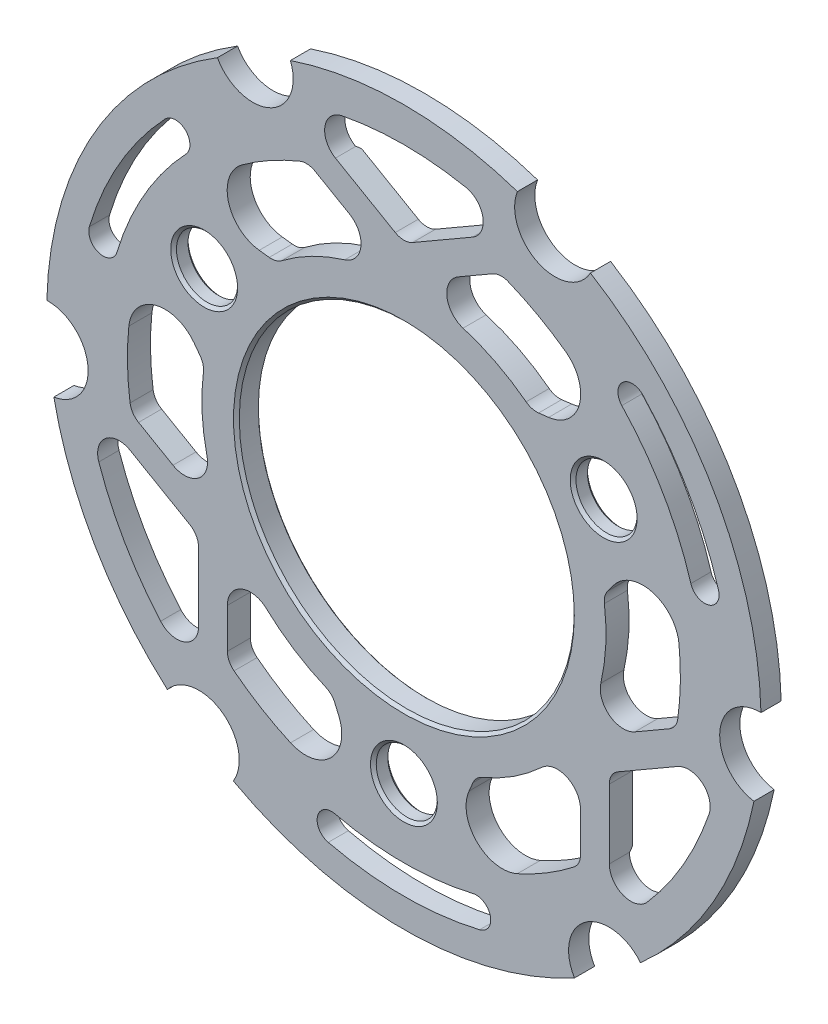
SolidWorks part; units mm, degrees
ref_plane "正面" through (0, 0, 0) normal (0, 0, 1) x (1, 0, 0)
ref_plane "平面" through (0, 0, 0) normal (0, 1, 0) x (1, 0, 0)
ref_plane "右側面" through (0, 0, 0) normal (1, 0, 0) x (0, 0, -1)
sketch "ｽｹｯﾁ1" plane through (0, 0, 0) normal (0, 0, 1) x (1, 0, 0)
  circle A0 centre (0, 0) radius 61.95
  dimension "D1" = 123.9
extrude "ﾎﾞｽ - 押し出し1" add sketch "ｽｹｯﾁ1" against normal blind 4 contours A0
sketch "ｽｹｯﾁ4" plane through (0, 0, -4) normal (0, 0, -1) x (-1, 0, 0)
  circle A0 centre (0, 0) radius 29.05
  dimension "D1" = 58.1
extrude "ｶｯﾄ - 押し出し3" cut sketch "ｽｹｯﾁ4" against normal blind 5
sketch "ｽｹｯﾁ10" plane through (0, 0, -4) normal (0, 0, -1) x (-1, 0, 0)
  circle A0 centre (0, 0) radius 49
  dimension "D1" = 98
extrude "ｶｯﾄ - 押し出し8" cut sketch "ｽｹｯﾁ10" against normal blind 0.5 flip side to cut
chamfer "面取り2" distance 0.5 angle 45 1 edges at (-49, 0, -3.5)
sketch "ｽｹｯﾁ2" plane through (0, 0, 0) normal (0, 0, 1) x (1, 0, 0)
  line L0 (0, 0) -> (-26.2023, 56.1911) construction
  line L1 (0, 0) -> (0, 72.6384) construction
  circle A0 centre (-26.2023, 56.1911) radius 7
  circle A1 centre (26.2023, 56.1911) radius 7
  point P7 (29.2694, 62.4844)
  point P8 (28.3449, 58.8101)
  point P10 (26.3, 56.1454)
  point P12 (-26.3, 56.1454)
  point P14 (0, 0)
  dimension "D1" = 14
  dimension "D2" = 62
  dimension "D3" = 25
extrude "ｶｯﾄ - 押し出し1" cut sketch "ｽｹｯﾁ2" against normal blind 5
sketch "ｽｹｯﾁ5" plane through (0, 0, -4) normal (0, 0, -1) x (-1, 0, 0)
  line L0 (0, -40) -> (0, 0) construction
  line L1 (0, 0) -> (34.641, 20) construction
  line L2 (34.641, 20) -> (0, 0) construction
  line L3 (0, 0) -> (-34.641, 20) construction
  circle A0 centre (0, 0) radius 40 construction
  circle A2 centre (34.641, 20) radius 5.3
  circle A3 centre (-34.641, 20) radius 5.3
  circle A4 centre (0, -40) radius 5.3
  dimension "D1" = 80
  dimension "D2" = 10.6
  dimension "D3" = 120
  dimension "D4" = 120
extrude "ｶｯﾄ - 押し出し4" cut sketch "ｽｹｯﾁ5" against normal through all contours A3 | A2
sketch "ｽｹｯﾁ7" plane through (0, 0, -4) normal (0, 0, -1) x (-1, 0, 0)
  circle A0 centre (0, -40) radius 8.6
  circle A1 centre (-34.641, 20) radius 8.6
  circle A2 centre (34.641, 20) radius 8.6
  point P9 (34.641, 20)
  point P11 (0, -40)
  point P13 (-34.641, 20)
  dimension "D1" = 17.2
extrude "ｶｯﾄ - 押し出し6" cut sketch "ｽｹｯﾁ7" against normal blind 1
sketch "ｽｹｯﾁ6" plane through (0, 0, -4) normal (0, 0, -1) x (-1, 0, 0)
  line L0 (25.0965, 27.5299) -> (23.363, 27.3247)
  line L5 (9.4338, 40.8027) -> (15.4029, 44.2489)
  line L8 (0, 0) -> (0, 54.3816) construction
  line L9 (11.875, 47.9856) -> (1.5, 41.9956)
  line L10 (-1.5, 41.9956) -> (-11.875, 47.9856)
  line L11 (-10, 51.2332) -> (10, 51.2332) construction
  line L12 (-10, 51.2332) -> (0, 0) construction
  line L13 (0, 0) -> (10, 51.2332) construction
  line L14 (24.356, 33.7862) -> (34.641, 20) construction
  line L15 (28.1232, 28.7366) -> (31.7586, 31.4487) construction
  line L16 (29.4985, 26.8931) -> (31.1414, 28.1187) construction
  line L17 (11.4338, 37.3386) -> (0, 37.3386) construction
  line L18 (-25.0965, 27.5299) -> (-23.363, 27.3247)
  line L19 (-9.4338, 40.8027) -> (-15.4029, 44.2489)
  circle A0 centre (0, 0) radius 49.05 construction
  arc A1 (-10.2626, 33.5139) -> (-9.4338, 40.8027) centre (-11.4338, 37.3386) ccw
  arc A16 (-10.2626, 33.5139) -> (-21.1961, 27.9146) centre (0, 0) ccw
  arc A17 (10.2626, 33.5139) -> (21.1961, 27.9146) centre (0, 0) cw
  arc A18 (18.031, 44.4307) -> (28.0401, 38.8967) centre (0, 0) cw
  circle A19 centre (0, 0) radius 29.05 construction
  arc A20 (19.6829, 58.74) -> (-19.6829, 58.74) centre (0, 0) ccw construction
  arc A21 (25.0965, 27.5299) -> (28.0401, 38.8967) centre (24.356, 33.7862) ccw
  arc A22 (21.1961, 27.9146) -> (23.363, 27.3247) centre (23.0104, 30.3039) ccw
  arc A23 (10.2626, 33.5139) -> (9.4338, 40.8027) centre (11.4338, 37.3386) cw
  arc A24 (18.031, 44.4307) -> (15.4029, 44.2489) centre (16.9029, 41.6509) ccw
  arc A25 (-10.7184, 54.9137) -> (10.7184, 54.9137) centre (0, 0) cw
  arc A26 (-10.7184, 54.9137) -> (-11.875, 47.9856) centre (-10, 51.2332) ccw
  arc A27 (10.7184, 54.9137) -> (11.875, 47.9856) centre (10, 51.2332) cw
  arc A28 (1.5, 41.9956) -> (-1.5, 41.9956) centre (0, 44.5937) cw
  circle A29 centre (34.641, 20) radius 8.6 construction
  arc A30 (-21.1961, 27.9146) -> (-23.363, 27.3247) centre (-23.0104, 30.3039) cw
  arc A31 (-25.0965, 27.5299) -> (-28.0401, 38.8967) centre (-24.356, 33.7862) cw
  arc A32 (-18.031, 44.4307) -> (-28.0401, 38.8967) centre (0, 0) ccw
  arc A33 (-18.031, 44.4307) -> (-15.4029, 44.2489) centre (-16.9029, 41.6509) cw
  point P31 (0, 41.1296)
  point P35 (0, 37.2648)
  point P37 (25.9961, 29.3308)
  dimension "D1" = 6
  dimension "D4" = 3
  dimension "D2" = 14
  dimension "D5" = 6
  dimension "D3" = 3
  dimension "D8" = 3.75
  dimension "D9" = 3
  dimension "D12" = 4
  dimension "D15" = 6.3
  dimension "D6" = 120
  dimension "D7" = 5
  dimension "D10" = 20
  dimension "D11" = 83.25
  dimension "D13" = 11.4338
  dimension "D14" = 2.3
extrude "ｶｯﾄ - 押し出し5" cut sketch "ｽｹｯﾁ6" against normal blind 5
sketch "ｽｹｯﾁ11" plane through (0, 0, -3.5) normal (0, 0, -1) x (-1, 0, 0)
  line L0 (0, 0) -> (47.1551, 27.225) construction
  arc A0 (39.6105, 37.3606) -> (52.1605, 15.6234) centre (0, 0) cw construction
  arc A1 (54.5553, 16.3407) -> (41.4291, 39.076) centre (0, 0) ccw
  arc A2 (49.7656, 14.906) -> (37.7918, 35.6452) centre (0, 0) ccw
  arc A3 (49.7656, 14.906) -> (54.5553, 16.3407) centre (52.1605, 15.6234) ccw
  arc A4 (41.4291, 39.076) -> (37.7918, 35.6452) centre (39.6105, 37.3606) ccw
  arc A5 (-32.3455, 52.8353) -> (32.3455, 52.8353) centre (0, 0) ccw construction
  point P4 (47.1551, 27.225)
  dimension "D1" = 5
  dimension "D2" = 5
  dimension "D3" = 25.1
extrude "ｶｯﾄ - 押し出し9" cut sketch "ｽｹｯﾁ11" against normal through all
pattern_circular "円形ﾊﾟﾀｰﾝ1" count 3 over 360 about axis through (0, 0, 0) along (0, 0, 1) of "ｶｯﾄ - 押し出し5", "ｶｯﾄ - 押し出し9", "ｶｯﾄ - 押し出し1"
chamfer "面取り3" distance 0.5 angle 45 6 edges at (-5.3, -40, -3) (-5.3, -40, 0) (29.341, 20, -3) (29.341, 20, 0) (-39.941, 20, -3) (-39.941, 20, 0)
chamfer "面取り4" distance 0.5 angle 45 1 edges at (29.05, 0, 0)
chamfer "面取り5" distance 0.2 angle 45 1 edges at (-29.05, 0, -4)
